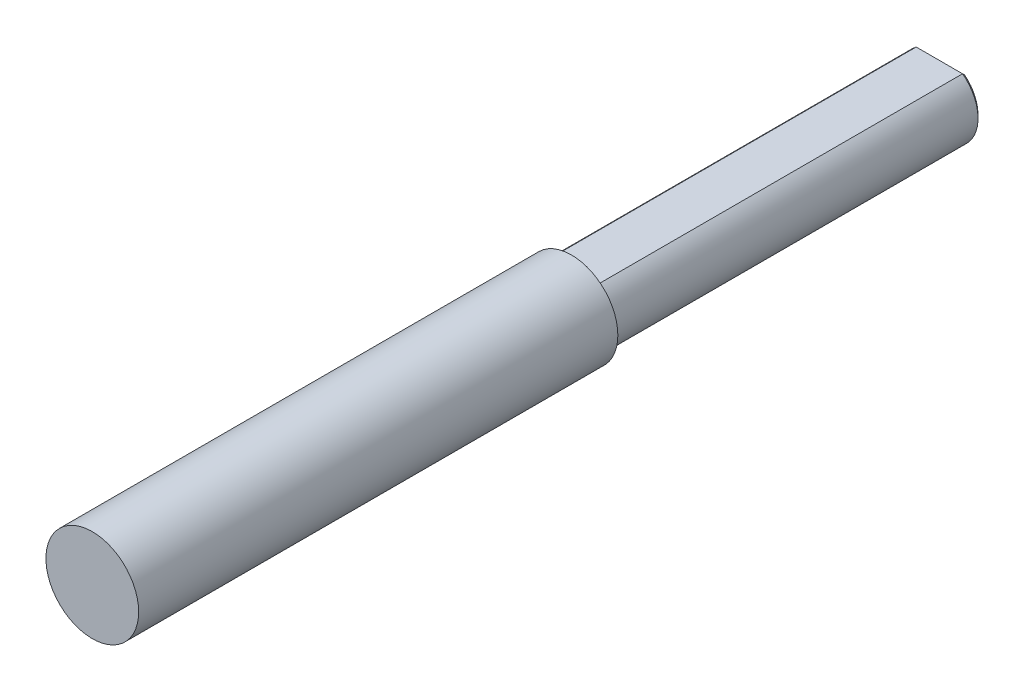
SolidWorks part; units mm, degrees
ref_plane "前视基准面" through (0, 0, 0) normal (0, 0, 1) x (1, 0, 0)
ref_plane "上视基准面" through (0, 0, 0) normal (0, 1, 0) x (1, 0, 0)
ref_plane "右视基准面" through (0, 0, 0) normal (1, 0, 0) x (0, 0, -1)
sketch "草图1" plane through (0, 0, 0) normal (0, 0, 1) x (1, 0, 0)
  line L0 (0, -2.5) -> (6.0766, -2.5) construction
  line L1 (-1.5, 2) -> (1.5, 2)
  arc A0 (-1.5, 2) -> (1.5, 2) centre (0, 0) ccw
  dimension "D1" = 5
  dimension "D2" = 4.5
extrude "凸台-拉伸1" add sketch "草图1" along normal blind 47
chamfer "倒角1" distance 0.2 angle 45 2 edges at (0, 2, 0) (0, -2.5, 0)
sketch "草图2" plane through (0, 0, 47) normal (0, 0, 1) x (1, 0, 0)
  circle A0 centre (0, 0) radius 3
extrude "凸台-拉伸2" add sketch "草图2" against normal blind 23
sketch "草图3" plane through (0, 0, 47) normal (0, 0, 1) x (1, 0, 0)
  circle A1 centre (0, 0) radius 3
  circle A2 centre (0, 0) radius 3
  dimension "D1" = 0
extrude "凸台-拉伸3" add sketch "草图3" along normal blind 8
